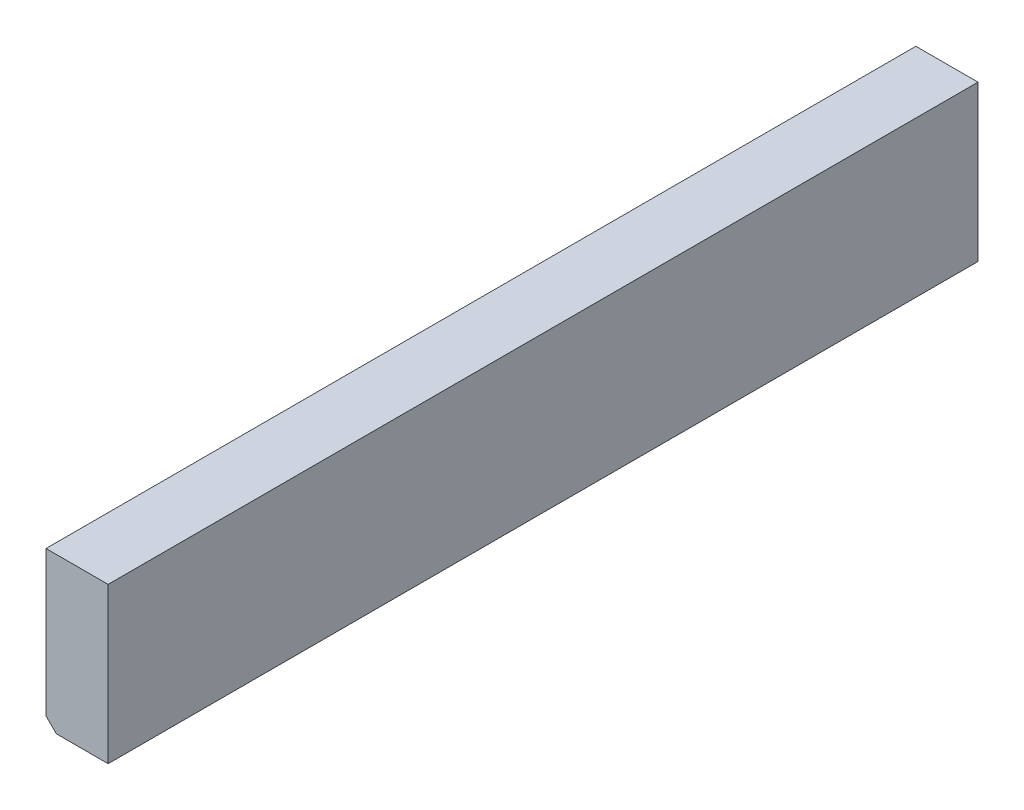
SolidWorks part; units mm, degrees
ref_plane "Face" through (0, 0, 0) normal (0, 0, 1) x (1, 0, 0)
ref_plane "Dessus" through (0, 0, 0) normal (0, 1, 0) x (1, 0, 0)
ref_plane "Droite" through (0, 0, 0) normal (1, 0, 0) x (0, 0, -1)
sketch "Esquisse1" plane through (0, 0, 0) normal (0, 0, 1) x (1, 0, 0)
  line L1 (0, 0) -> (3, 0)
  line L2 (0, 0) -> (0, 7.5)
  line L3 (0, 7.5) -> (3, 7.5)
  line L4 (3, 0) -> (3, 7.5)
  dimension "D1" = 3
  dimension "D2" = 7.5
extrude "Base-Extrusion" add sketch "Esquisse1" against normal blind 42
chamfer "Chanfrein3" distance 0.5 angle 45
